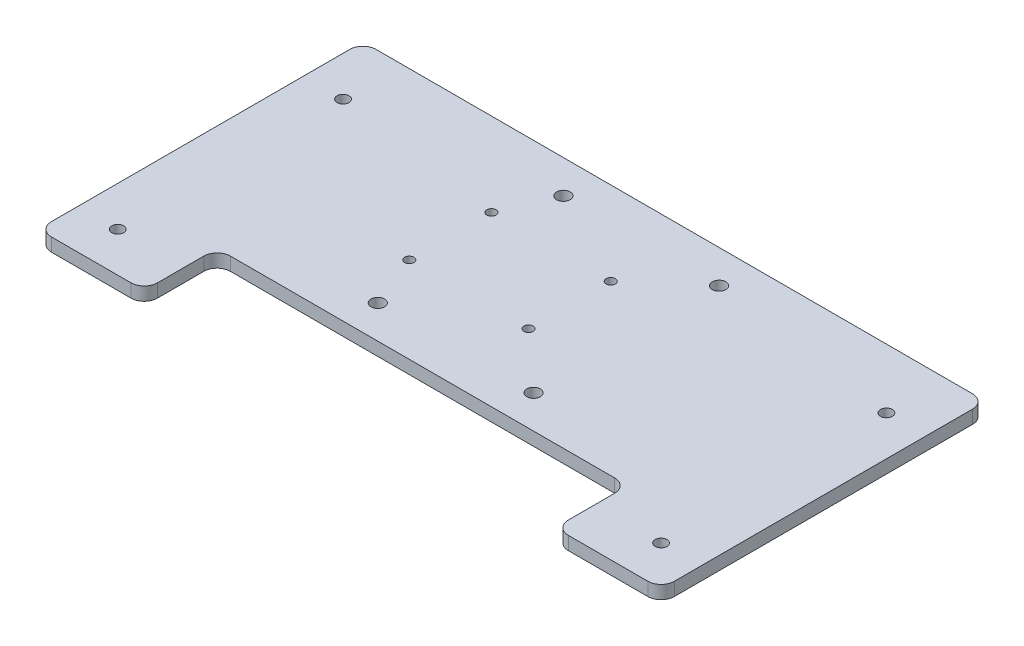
SolidWorks part; units mm, degrees
ref_plane "Plan1" through (0, 0, 0) normal (0, 0, 1) x (1, 0, 0)
ref_plane "Plan2" through (0, 0, 0) normal (0, 1, 0) x (1, 0, 0)
ref_plane "Plan3" through (0, 0, 0) normal (1, 0, 0) x (0, 0, -1)
sketch "Esquisse1" plane through (0, 0, 0) normal (0, 1, 0) x (1, 0, 0)
  line L0 (0, 0) -> (0, 245) construction
  line L1 (165, 0) -> (225, 0)
  line L2 (-145, 55) -> (145, 55)
  line L3 (-225, 245) -> (225, 245)
  line L4 (235, 10) -> (235, 235)
  line L5 (155, 45) -> (155, 10)
  line L6 (-155, 45) -> (-155, 10)
  line L7 (-235, 10) -> (-235, 235)
  line L8 (-165, 0) -> (-225, 0)
  arc A0 (155, 45) -> (145, 55) centre (145, 45) ccw
  arc A1 (165, 0) -> (155, 10) centre (165, 10) cw
  arc A2 (235, 10) -> (225, 0) centre (225, 10) cw
  arc A3 (225, 245) -> (235, 235) centre (225, 235) cw
  circle A4 centre (205, 200) radius 4.5
  circle A5 centre (205, 30) radius 4.5
  circle A6 centre (-205, 30) radius 4.5
  circle A7 centre (-205, 200) radius 4.5
  arc A8 (-225, 245) -> (-235, 235) centre (-225, 235) ccw
  arc A9 (-235, 10) -> (-225, 0) centre (-225, 10) ccw
  arc A10 (-165, 0) -> (-155, 10) centre (-165, 10) ccw
  arc A11 (-155, 45) -> (-145, 55) centre (-145, 45) cw
  circle A12 centre (-75, 182) radius 3.5
  circle A13 centre (-75, 120) radius 3.5
  circle A14 centre (15, 182) radius 3.5
  circle A15 centre (15, 120) radius 3.5
  point P14 (235, 0)
  point P17 (235, 245)
  point P38 (0, 55)
  dimension "D5" = 10
  dimension "D6" = 30
  dimension "D7" = 170
  dimension "D9" = 9
  dimension "D10" = 9
  dimension "D11" = 7
  dimension "D12" = 7
  dimension "D13" = 7
  dimension "D14" = 7
  dimension "D17" = 90
  dimension "D1" = 235
  dimension "D2" = 245
  dimension "D3" = 190
  dimension "D4" = 80
  dimension "D8" = 205
  dimension "D15" = 65
  dimension "D16" = 62
  dimension "D18" = 160
extrude "Base-Extrusion" add sketch "Esquisse1" along normal blind 10
sketch "Esquisse2" plane through (0, 10, 0) normal (0, 1, 0) x (-1, 0, 0)
  line L0 (145, -55) -> (-145, -55) construction
  line L1 (-225, -245) -> (225, -245) construction
  circle A0 centre (58.75, -80) radius 5.125
  circle A1 centre (-58.75, -80) radius 5.125
  circle A2 centre (58.75, -220) radius 5.125
  circle A3 centre (-58.75, -220) radius 5.125
  dimension "D2" = 58.75
  dimension "D3" = 10.25
  dimension "D4" = 10.25
  dimension "D5" = 10.25
  dimension "D6" = 10.25
  dimension "D8" = 25
  dimension "D1" = 58.75
  dimension "D7" = 25
extrude "Enlèv. mat.-Extru.1" cut sketch "Esquisse2" against normal through all
ref_plane "Plan4" through (0, 0, -220) normal (0, 0, -1) x (-1, 0, 0)
ref_plane "Plan5" through (0, 0, -80) normal (0, 0, 1) x (1, 0, 0)
